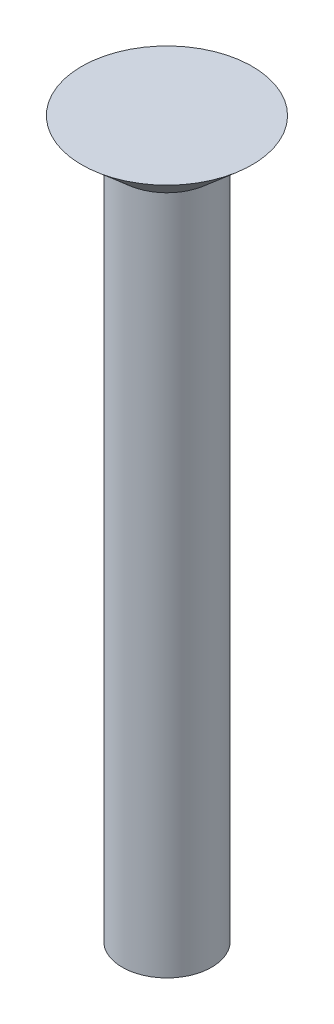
SolidWorks part; units mm, degrees
ref_plane "Front Plane" through (0, 0, 0) normal (0, 0, 1) x (1, 0, 0)
ref_plane "Top Plane" through (0, 0, 0) normal (0, 1, 0) x (1, 0, 0)
ref_plane "Right Plane" through (0, 0, 0) normal (1, 0, 0) x (0, 0, -1)
sketch "Sketch1" plane through (0, 0, 0) normal (0, 0, 1) x (1, 0, 0)
  line L0 (0, 0) -> (0, -50.8) construction
  line L1 (0, 0) -> (6.0579, 0)
  line L2 (6.0579, 0) -> (3.175, -2.5061)
  line L3 (3.175, -2.5061) -> (3.175, -50.8)
  line L4 (3.175, -50.8) -> (0, -50.8)
  line L5 (0, 0) -> (0, -50.8)
  dimension "D1" = 12.1158
  dimension "D2" = 6.35
  dimension "D3" = 41
  dimension "D4" = 50.8
revolve "Revolve1" add sketch "Sketch1" angle 360 about L0
